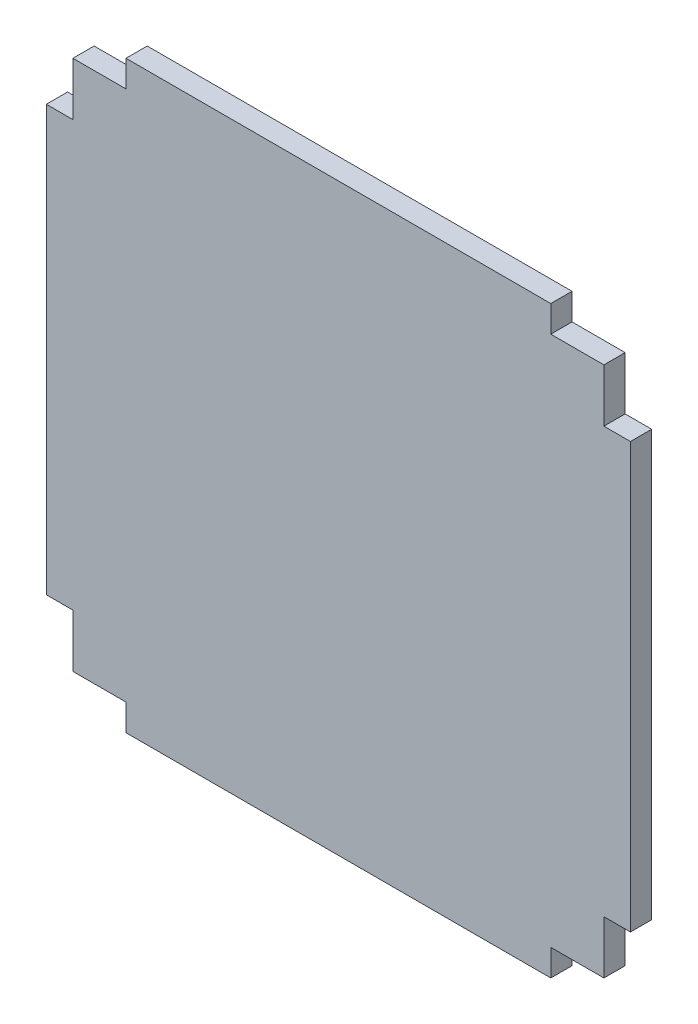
SolidWorks part; units mm, degrees
ref_plane "Front Plane" through (0, 0, 0) normal (0, 0, 1) x (1, 0, 0)
ref_plane "Top Plane" through (0, 0, 0) normal (0, 1, 0) x (1, 0, 0)
ref_plane "Right Plane" through (0, 0, 0) normal (1, 0, 0) x (0, 0, -1)
sketch "Sketch1" plane through (0, 0, 0) normal (0, 0, 1) x (1, 0, 0)
  line L0 (0, 0) -> (0, 68.4932) construction
  line L1 (0, 55) -> (-40, 55)
  line L2 (0, 55) -> (40, 55)
  line L3 (-40, 55) -> (-40, 50)
  line L4 (40, 55) -> (40, 50)
  line L5 (-40, 50) -> (-50, 50)
  line L6 (40, 50) -> (50, 50)
  line L7 (-50, 50) -> (-50, 40)
  line L8 (50, 50) -> (50, 40)
  line L9 (-50, 40) -> (-55, 40)
  line L10 (50, 40) -> (55, 40)
  line L11 (-55, 40) -> (-55, -40)
  line L12 (55, 40) -> (55, -40)
  line L13 (-55, -40) -> (-50, -40)
  line L14 (55, -40) -> (50, -40)
  line L15 (-50, -40) -> (-50, -50)
  line L16 (50, -40) -> (50, -50)
  line L17 (-50, -50) -> (-40, -50)
  line L18 (50, -50) -> (40, -50)
  line L19 (-40, -50) -> (-40, -55)
  line L20 (40, -50) -> (40, -55)
  line L21 (-40, -55) -> (40, -55)
  point P24 (-55, 0)
  point P25 (32.0157, 56.1252)
  point P26 (40, 56.1252)
  dimension "D1" = 80
  dimension "D2" = 80
  dimension "D3" = 110
  dimension "D4" = 100
  dimension "D5" = 100
  dimension "D6" = 110
extrude "Boss-Extrude1" add sketch "Sketch1" along normal blind 4
